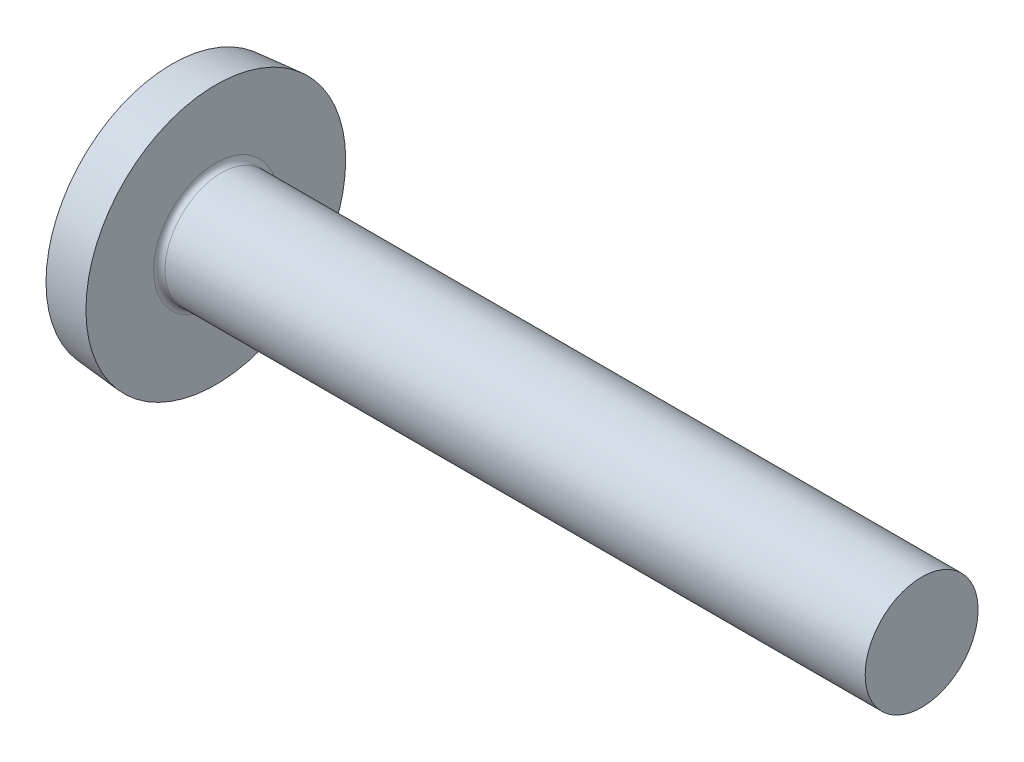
SolidWorks part; units mm, degrees
ref_plane "Front Plane" through (0, 0, 0) normal (0, 0, 1) x (1, 0, 0)
ref_plane "Top Plane" through (0, 0, 0) normal (0, 1, 0) x (1, 0, 0)
ref_plane "Right Plane" through (0, 0, 0) normal (1, 0, 0) x (0, 0, -1)
sketch "BodySke" plane through (0, 0, 0) normal (0, 0, 1) x (1, 0, 0)
  line L0 (0, 0) -> (64.6736, 0) construction
  line L1 (0, 0) -> (0, 8) construction
  line L2 (4.8, 4) -> (4.8, 9.2)
  line L3 (4.8, 9.2) -> (1.7, 8.9288)
  line L4 (4.8, 4) -> (54.8, 4)
  line L5 (54.8, 4) -> (54.8, 0)
  line L6 (6.05, 7.824) -> (6.05, -6.8939) construction
  line L7 (0, 0) -> (54.8, 0)
  line L8 (24.8, 8.3681) -> (24.8, -5.4139) construction
  arc A0 (0, 0) -> (1.7, 8.9288) centre (24.298, 0) cw
  point P10 (54.8, 3.4455)
  dimension "Diameter" = 8
  dimension "Head_dia" = 18.4
  dimension "Head_height" = 3.1
  dimension "Length" = 50
  dimension "Advance" = 1.25
  dimension "Thread_minor" = 6.891
  dimension "Thread_length" = 30
  dimension "Head_side_ang" = 5
  dimension "Oval_height" = 1.7
revolve "BaseBody" add sketch "BodySke" angle 360 about L0
fillet "Fillet1" radius 0.4 1 edges at (4.8, 0, 4)
ref_plane "Plane1" through (4.38, 0, 0) normal (1, 0, 0) x (0, 0, -1)
sketch "RecSkeTop" plane through (0, 0, 0) normal (1, 0, 0) x (0, 0, -1)
  line L1 (-0.858, 3.9) -> (0.858, 3.9)
  line L2 (-0.858, 3.9) -> (-0.858, -3.9)
  line L3 (-0.858, -3.9) -> (0.858, -3.9)
  line L4 (0.858, 3.9) -> (0.858, -3.9)
  dimension "D1" = 3.9
  dimension "Cross_dia" = 7.8
  dimension "D2" = 1.716
  dimension "D3" = 0.858
sketch "RecSkeBot" plane through (4.38, 0, 0) normal (1, 0, 0) x (0, 0, -1)
  line L0 (-0.858, 3.9) -> (-0.858, -3.9) construction
  line L1 (-0.858, 1.7162) -> (0.858, 1.7162)
  line L2 (-0.858, 1.7162) -> (-0.858, -1.7162)
  line L3 (-0.858, -1.7162) -> (0.858, -1.7162)
  line L4 (0.858, 1.7162) -> (0.858, -1.7162)
  line L5 (0.858, 3.9) -> (0.858, -3.9) construction
  dimension "D1" = 3.4324
  dimension "D2" = 1.7162
loft "Recess" cut profiles "RecSkeTop", "RecSkeBot"
pattern_circular "RecPat" count 2 every 90 about axis through (0, 0, 0) along (1, 0, 0) of "Recess"
sketch "RecCorSke" plane through (0, 0, 0) normal (0, 0, 1) x (1, 0, 0)
  line L0 (0, 0) -> (57.5987, 0) construction
  line L1 (0, 0) -> (0, 1.8876)
  line L3 (0, 1.8876) -> (4.38, 1.5813)
  line L4 (4.38, 1.5813) -> (4.8938, 0)
  line L5 (4.8938, 0) -> (0, 0)
  dimension "D1" = 18
  dimension "D2" = 4.38
  dimension "D3" = 1.8876
  dimension "D4" = 4
revolve "RecessCore" cut sketch "RecCorSke" angle 360 about L0
sketch "ThdSchSke" plane through (0, 0, 0) normal (0, 0, 1) x (1, 0, 0)
  line L0 (0, 0) -> (55.1256, 0) construction
  line L1 (0, 0) -> (64.6736, 0) construction
  line L2 (54.4799, 4) -> (54.4799, 4.6403)
  line L3 (54.4799, 4.6403) -> (55.1201, 4.6403)
  line L4 (55.1201, 4.6403) -> (55.1201, 4)
  line L5 (55.1201, 4) -> (54.8, 3.4455)
  line L6 (54.8, 3.4455) -> (54.4799, 4)
  line L7 (4.8, 4) -> (54.8, 4) construction
  line L13 (54.8, 4) -> (54.8, 0) construction
revolve "ThreadSchematic" [suppressed] cut sketch "ThdSchSke" angle 360 about L0
pattern_linear "ThdSchPat" [suppressed] count 24 along (1, 0, 0)
equation "\"Thread_minor@ThreadCosmetic\" = \"Thread_minor@BodySke\""
equation "\"D1@RecSkeTop\" = \"Cross_dia@RecSkeTop\" / 2"
equation "\"D2@RecSkeTop\" = \"Cross_dia@RecSkeTop\" * 0.22"
equation "\"D3@RecSkeTop\" = \"D2@RecSkeTop\" / 2"
equation "\"D1@RecSkeBot\" = \"Cross_dia@RecSkeTop\" - 2 * \"Cross_depth@Plane1\" *  tan( 26.5 * 0.017453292 ) "
equation "\"D2@RecSkeBot\" = \"D1@RecSkeBot\" / 2"
equation "\"D2@RecCorSke\" = \"Cross_depth@Plane1\""
equation "\"D3@RecCorSke\" = \"D2@RecSkeTop\" * 1.1"
equation "\"Advance@ThdSchPat\" = \"Advance@BodySke\""
equation "\"D1@ThdSchPat\" =  int( \"Thread_length@BodySke\" / \"Advance@ThdSchPat\" ) "
